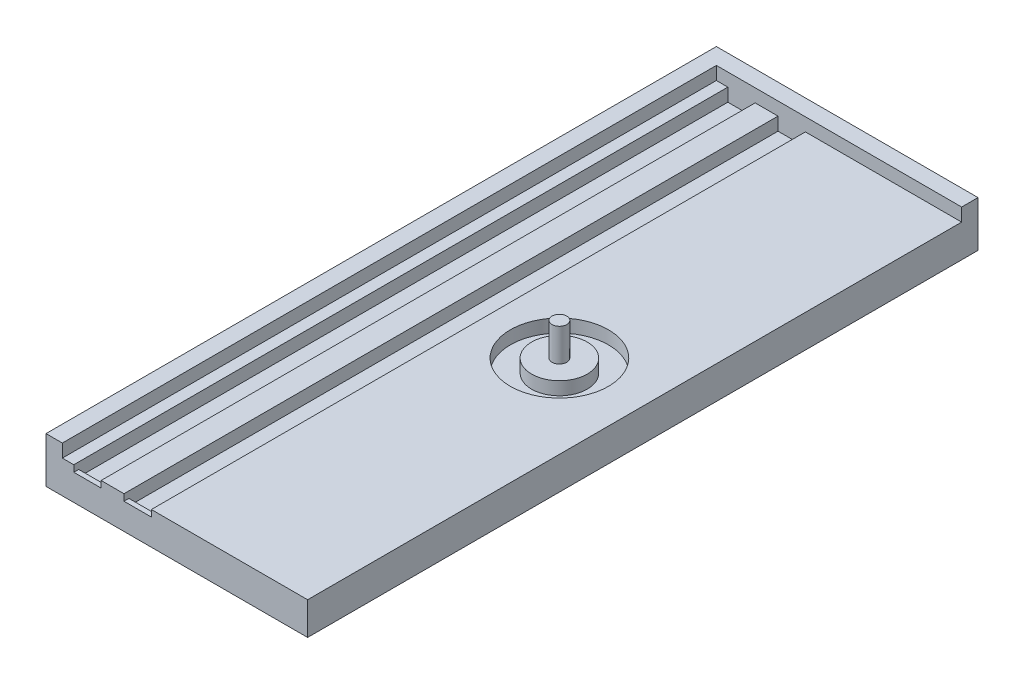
SolidWorks part; units mm, degrees
ref_plane "Front Plane" through (0, 0, 0) normal (0, 0, 1) x (1, 0, 0)
ref_plane "Top Plane" through (0, 0, 0) normal (0, 1, 0) x (1, 0, 0)
ref_plane "Right Plane" through (0, 0, 0) normal (1, 0, 0) x (0, 0, -1)
sketch "Sketch2" plane through (0, 0, 0) normal (0, 1, 0) x (1, 0, 0)
  line L1 (40, -102.5) -> (-40, -102.5)
  line L2 (40, -102.5) -> (40, 102.5)
  line L3 (40, 102.5) -> (-40, 102.5)
  line L4 (-40, -102.5) -> (-40, 102.5)
  line L5 (40, -102.5) -> (-40, 102.5) construction
  line L6 (40, 102.5) -> (-40, -102.5) construction
  point P0 (0, 0)
  dimension "D1" = 205
  dimension "D2" = 80
extrude "Boss-Extrude1" add sketch "Sketch2" along normal blind 10
sketch "Sketch5" plane through (0, 10, 0) normal (0, 1, 0) x (1, 0, 0)
  line L0 (40, 97.5) -> (-35, 97.5)
  line L1 (40, -102.5) -> (40, 102.5) construction
  line L2 (-40, 102.5) -> (-40, -102.5) construction
  line L3 (40, 102.5) -> (-40, 102.5) construction
  line L4 (-35, 97.5) -> (-35, -102.5)
  line L5 (-40, -102.5) -> (40, -102.5) construction
  line L6 (-35, -102.5) -> (-40, -102.5)
  line L7 (40, 97.5) -> (40, 102.5)
  line L8 (-40, 102.5) -> (-40, -102.5)
  line L9 (40, 102.5) -> (-40, 102.5)
  dimension "D1" = 5
  dimension "D2" = 5
extrude "Boss-Extrude2" add sketch "Sketch5" along normal blind 4
sketch "Sketch6" plane through (0, 10, 0) normal (0, 1, 0) x (1, 0, 0)
  line L0 (-35, 97.5) -> (40, 97.5) construction
  line L1 (-31.5, 97.5) -> (-23.15, 97.5)
  line L2 (-31.5, 97.5) -> (-31.5, -102.5)
  line L3 (-31.5, -102.5) -> (-23.15, -102.5)
  line L4 (-23.15, 97.5) -> (-23.15, -102.5)
  line L5 (-35, -102.5) -> (40, -102.5) construction
  line L6 (-35, -102.5) -> (-35, 97.5) construction
  line L8 (-35, -102.5) -> (-35, 97.5) construction
  line L9 (-16.15, 97.5) -> (-16.15, -102.5)
  line L10 (-35, 97.5) -> (40, 97.5) construction
  line L11 (-16.15, -102.5) -> (-7.78, -102.5)
  line L12 (-7.78, -102.5) -> (-7.78, 97.5)
  line L13 (-7.78, 97.5) -> (-16.15, 97.5)
  dimension "D1" = 3.5
  dimension "D2" = 11.85
  dimension "D3" = 18.85
  dimension "D4" = 27.22
extrude "Cut-Extrude2" cut sketch "Sketch6" against normal blind 4
sketch "Sketch7" plane through (0, 10, 0) normal (0, 1, 0) x (1, 0, 0)
  line L0 (-104.7752, 0) -> (111.5417, 0) construction
  line L1 (-35, -102.5) -> (-35, 97.5) construction
  circle A0 centre (14.5, 0) radius 8.5
  circle A1 centre (14.5, 0) radius 15
  dimension "D1" = 49.5
  dimension "D2" = 30
  dimension "D3" = 6.5
extrude "Cut-Extrude3" cut sketch "Sketch7" against normal blind 4
sketch "Sketch8" plane through (0, 10, 0) normal (0, 1, 0) x (1, 0, 0)
  circle A0 centre (14.5, 0) radius 2.25
  dimension "D1" = 4.5
extrude "Boss-Extrude3" add sketch "Sketch8" along normal blind 10
sketch "Sketch9" plane through (0, 0, 102.5) normal (0, 0, 1) x (1, 0, 0)
  line L0 (-7.78, 6) -> (-7.78, 10) construction
  line L1 (-7.78, 6) -> (-16.15, 6) construction
  line L2 (-16.15, 6) -> (-16.15, 10) construction
  line L3 (-23.15, 6) -> (-23.15, 10) construction
  line L4 (-31.5, 6) -> (-23.15, 6) construction
  line L5 (-31.5, 6) -> (-31.5, 10) construction
  line L6 (-7.78, 6) -> (-7.78, 8)
  line L7 (-7.78, 6) -> (-16.15, 6)
  line L8 (-16.15, 6) -> (-16.15, 8)
  line L9 (-23.15, 6) -> (-23.15, 8)
  line L10 (-31.5, 6) -> (-23.15, 6)
  line L11 (-31.5, 6) -> (-31.5, 8)
  line L12 (-31.5, 8) -> (-23.15, 8)
  line L13 (-16.15, 8) -> (-7.78, 8)
extrude "Boss-Extrude4" add sketch "Sketch9" against normal blind 1.5
